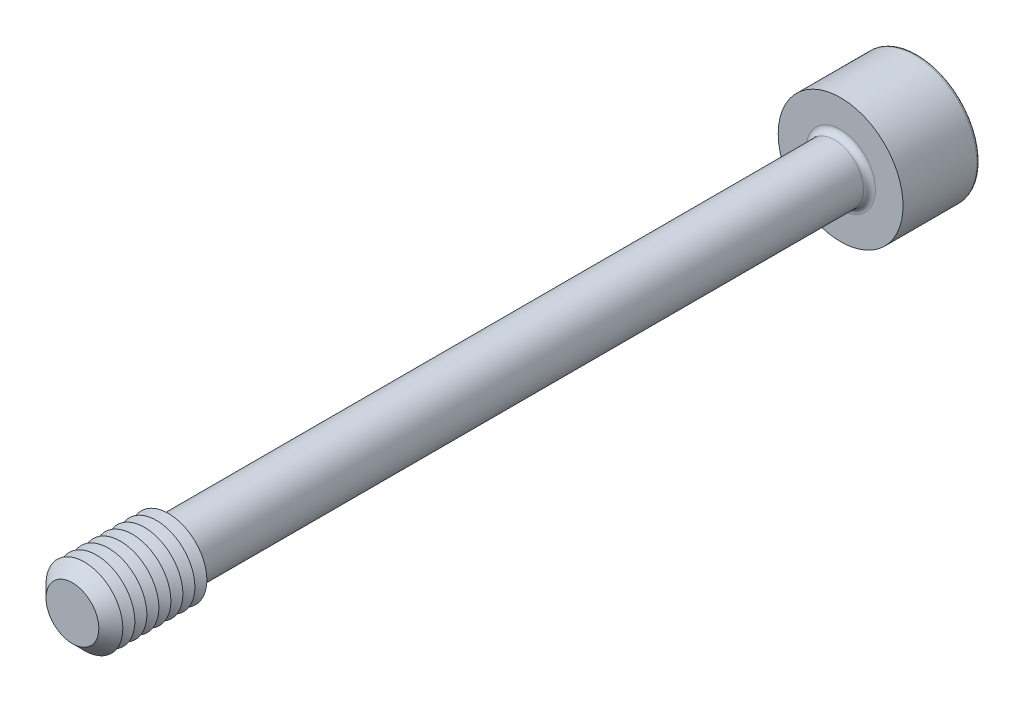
SolidWorks part; units mm, degrees
ref_plane "Front Plane" through (0, 0, 0) normal (0, 0, 1) x (1, 0, 0)
ref_plane "Top Plane" through (0, 0, 0) normal (0, 1, 0) x (1, 0, 0)
ref_plane "Right Plane" through (0, 0, 0) normal (1, 0, 0) x (0, 0, -1)
sketch "Sketch1" plane through (0, 0, 0) normal (0, 0, 1) x (1, 0, 0)
  circle A0 centre (0, 0) radius 3
  dimension "D1" = 6
extrude "Extrude1" add sketch "Sketch1" along normal mid plane 80
sketch "Sketch2" plane through (0, 0, 0) normal (1, 0, 0) x (0, 0, -1)
  line L0 (-40, 0) -> (-40, 4)
  line L1 (-40, 3) -> (-40, -3) construction
  line L2 (-40, 4) -> (-30, 4)
  line L3 (-30, 4) -> (-29.4226, 3)
  line L4 (40, 3) -> (-40, 3) construction
  line L5 (-29.4226, 3) -> (-29.4226, 0)
  line L6 (-29.4226, 0) -> (-40, 0)
  dimension "D1" = 4
  dimension "D2" = 120
  dimension "D3" = 10
revolve "Revolve1" add sketch "Sketch2" angle 360 about L6
chamfer "Chamfer1" distance 1.25 angle 45 1 edges at (0, 4, 40)
sketch "Sketch3" plane through (0, 0, -40) normal (0, 0, -1) x (-1, 0, 0)
  circle A0 centre (0, 0) radius 6.5
  dimension "D1" = 13
extrude "Extrude2" add sketch "Sketch3" along normal blind 8
sketch "Sketch4" plane through (-13.7, 0, -48) normal (0, 0, 1) x (1, 0, 0)
  line L2 (11.9679, -3) -> (15.4321, -3)
  line L3 (15.4321, -3) -> (17.1641, 0)
  line L4 (17.1641, 0) -> (15.4321, 3)
  line L6 (15.4321, 3) -> (11.9679, 3)
  line L7 (11.9679, 3) -> (10.2359, 0)
  line L8 (10.2359, 0) -> (11.9679, -3)
  circle A0 centre (13.7, 0) radius 3 construction
  dimension "D1" = 6
extrude "Extrude3" cut sketch "Sketch4" along normal blind 6
fillet "Fillet1" radius 0.62 1 edges at (-3, 0, -40)
fillet "Fillet2" radius 0.31 1 edges at (-6.5, 0, -48)
sketch "Sketch5" plane through (0, 0, 0) normal (1, 0, 0) x (0, 0, -1)
  line L0 (42, 0) -> (42, -3)
  line L1 (42, -3) -> (40.2679, 0)
  line L2 (40.2679, 0) -> (42, 0)
  dimension "D1" = 30
revolve "Cut-Revolve1" cut sketch "Sketch5" angle 360 about L2
sketch "Sketch6" plane through (0, 0, 0) normal (1, 0, 0) x (0, 0, -1)
  line L0 (1.332, 0) -> (-13.289, 0) construction
sketch "Sketch7" plane through (0, 0, 0) normal (1, 0, 0) x (0, 0, -1)
  line L0 (-30, 4) -> (-30.625, 2.9175)
  line L1 (-30.625, 2.9175) -> (-31.25, 4)
  line L2 (-30, 4) -> (-38.75, 4) construction
  line L3 (-31.25, 4) -> (-30, 4)
  dimension "D1" = 1.25
revolve "Cut-Revolve2" cut sketch "Sketch7" angle 360 about L0
pattern_linear "LPattern1" count 7 spacing 1.25 along (0, 0, 1) of "Cut-Revolve2"
